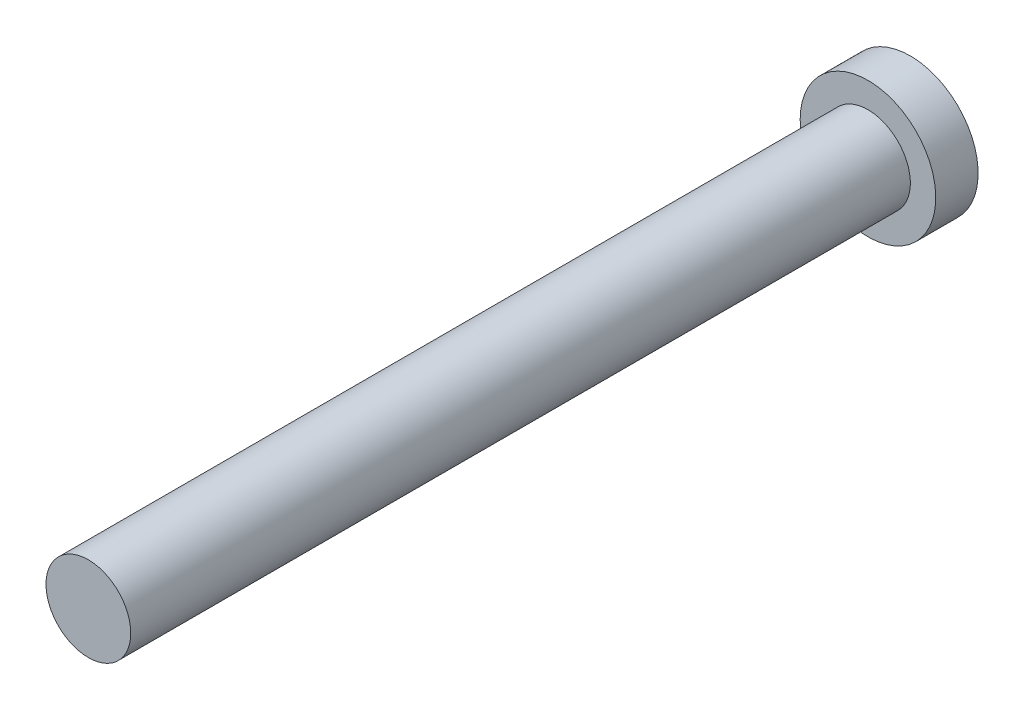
SolidWorks part; units mm, degrees
ref_plane "Plan de face" through (0, 0, 0) normal (0, 0, 1) x (1, 0, 0)
ref_plane "Plan de dessus" through (0, 0, 0) normal (0, 1, 0) x (1, 0, 0)
ref_plane "Plan de droite" through (0, 0, 0) normal (1, 0, 0) x (0, 0, -1)
sketch "Esquisse1" plane through (0, 0, 0) normal (0, 0, 1) x (1, 0, 0)
  circle A0 centre (0, 0) radius 5
  dimension "D1" = 10
extrude "Extrusion1" add sketch "Esquisse1" along normal blind 92
sketch "Esquisse2" plane through (0, 0, 0) normal (0, 0, -1) x (-1, 0, 0)
  circle A0 centre (0, 0) radius 8
  dimension "D1" = 16
extrude "Extrusion2" add sketch "Esquisse2" along normal blind 5
